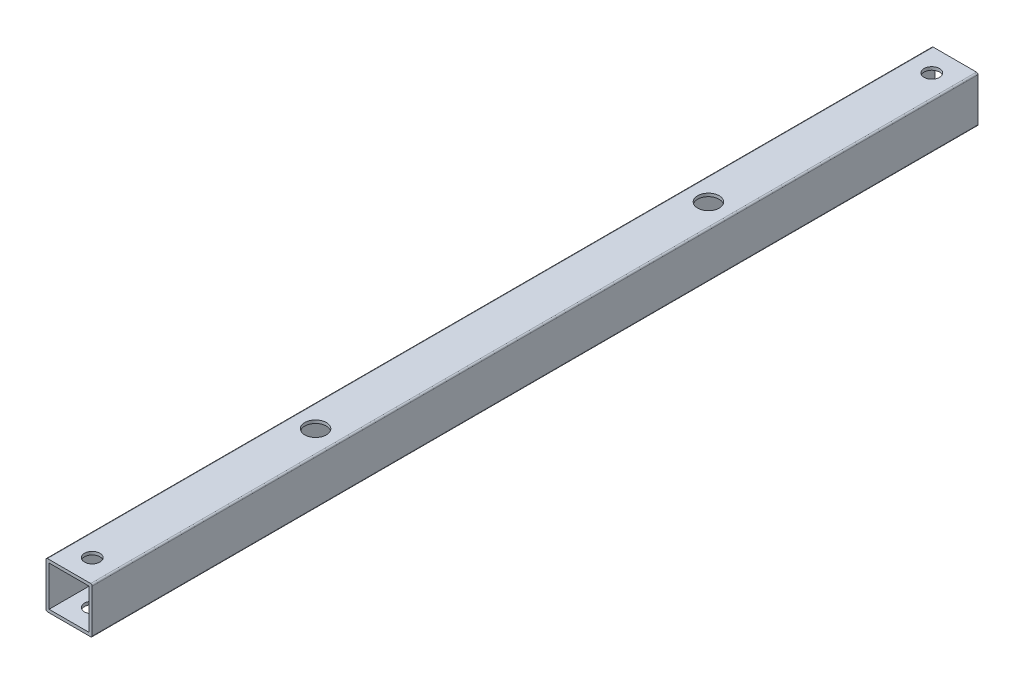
SolidWorks part; units mm, degrees
ref_plane "Plan1" through (0, 0, 0) normal (0, 0, 1) x (1, 0, 0)
ref_plane "Plan2" through (0, 0, 0) normal (0, 1, 0) x (1, 0, 0)
ref_plane "Plan3" through (0, 0, 0) normal (1, 0, 0) x (0, 0, -1)
sketch "Esquisse1" plane through (0, 0, 0) normal (0, 0, 1) x (1, 0, 0)
  line L0 (-14, 15) -> (14, 15)
  line L1 (-15, 14) -> (-15, -14)
  line L2 (14, -15) -> (-14, -15)
  line L3 (15, -14) -> (15, 14)
  line L4 (14, 14) -> (-14, -14) construction
  arc A0 (-14, -15) -> (-15, -14) centre (-14, -14) cw
  arc A1 (-15, 14) -> (-14, 15) centre (-14, 14) cw
  arc A2 (15, 14) -> (14, 15) centre (14, 14) ccw
  arc A3 (15, -14) -> (14, -15) centre (14, -14) cw
  dimension "D1" = 1
  dimension "D2" = 30
extrude "Base-Extru.-Mince" add sketch "Esquisse1" along normal blind 575 thin
sketch "Esquisse2" plane through (0, 15, 0) normal (0, 1, 0) x (-1, 0, 0)
  line L0 (14, 575) -> (-14, 575) construction
  circle A0 centre (0, 15) radius 5
  circle A1 centre (0, 160) radius 5
  circle A3 centre (0, 560) radius 5
  circle A4 centre (0, 415) radius 5
  dimension "D1" = 10
  dimension "D2" = 145
  dimension "D5" = 255
  dimension "D3" = 145
  dimension "D4" = 15
  dimension "D6" = 15
extrude "Enlèv. mat.-Extru.1" cut sketch "Esquisse2" against normal blind 35
sketch "Esquisse3" plane through (0, 15, 0) normal (0, 1, 0) x (-1, 0, 0)
  circle A0 centre (0, 160) radius 7
  circle A1 centre (0, 415) radius 7
  dimension "D1" = 14
extrude "Enlèv. mat.-Extru.2" cut sketch "Esquisse3" against normal blind 3
